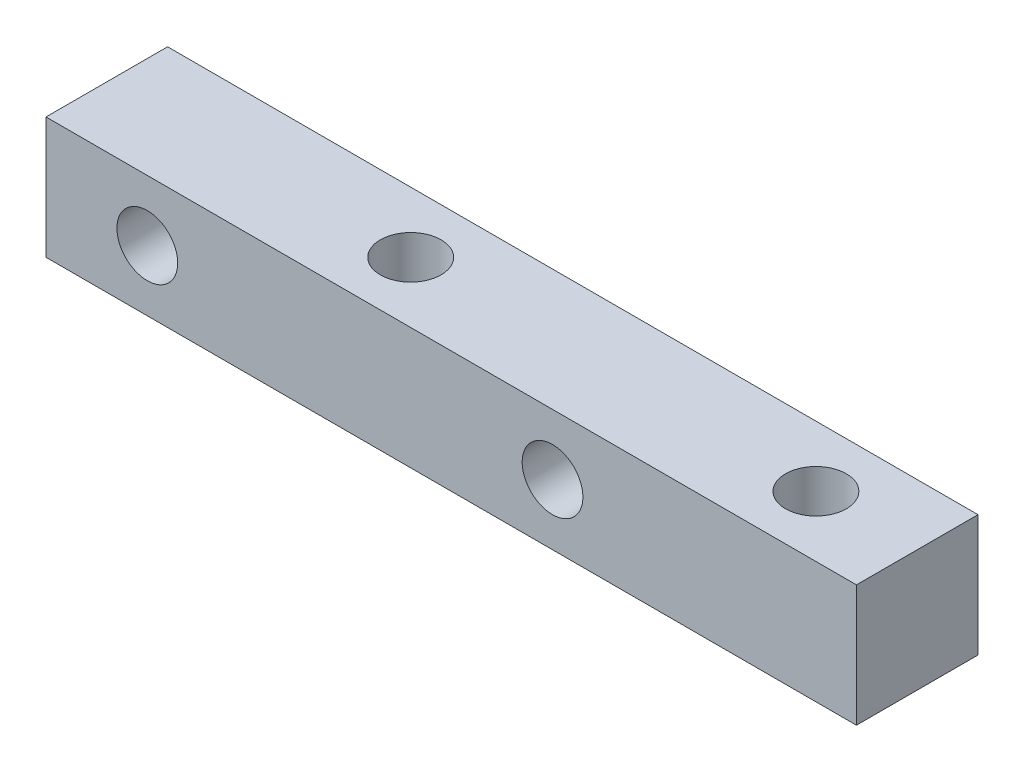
SolidWorks part; units mm, degrees
ref_plane "前视基准面" through (0, 0, 0) normal (0, 0, 1) x (1, 0, 0)
ref_plane "上视基准面" through (0, 0, 0) normal (0, 1, 0) x (1, 0, 0)
ref_plane "右视基准面" through (0, 0, 0) normal (1, 0, 0) x (0, 0, -1)
sketch "草图1" plane through (0, 0, 0) normal (0, 1, 0) x (1, 0, 0)
  line L1 (-20, 3) -> (20, 3)
  line L2 (-20, 3) -> (-20, -3)
  line L3 (-20, -3) -> (20, -3)
  line L4 (20, 3) -> (20, -3)
  line L5 (-20, 3) -> (20, -3) construction
  line L6 (-20, -3) -> (20, 3) construction
  point P0 (0, 0)
  dimension "D1" = 6
  dimension "D2" = 40
extrude "凸台-拉伸1" add sketch "草图1" along normal blind 6
sketch "草图2" plane through (0, 6, 0) normal (0, 1, 0) x (1, 0, 0)
  line L0 (-5, 0) -> (15, 0) construction
  line L1 (20, -3) -> (20, 3) construction
  line L2 (-20, 3) -> (-20, -3) construction
  line L3 (-20, 0) -> (20, 0) construction
  circle A0 centre (15, 0) radius 1.5
  circle A1 centre (-5, 0) radius 1.5
  dimension "D4" = 3
  dimension "D5" = 3
  dimension "D1" = 20
  dimension "D2" = 5
  dimension "D3" = 15
extrude "切除-拉伸1" cut sketch "草图2" against normal through all
sketch "草图3" plane through (0, 0, -3) normal (0, 0, -1) x (-1, 0, 0)
  line L0 (-20, 3) -> (20, 3) construction
  line L1 (-20, 6) -> (-20, 0) construction
  line L2 (20, 6) -> (20, 0) construction
  circle A0 centre (15, 3) radius 1.5
  circle A1 centre (-5, 3) radius 1.5
  dimension "D2" = 3
  dimension "D3" = 3
  dimension "D1" = 5
  dimension "D4" = 20
extrude "切除-拉伸2" cut sketch "草图3" against normal through all
